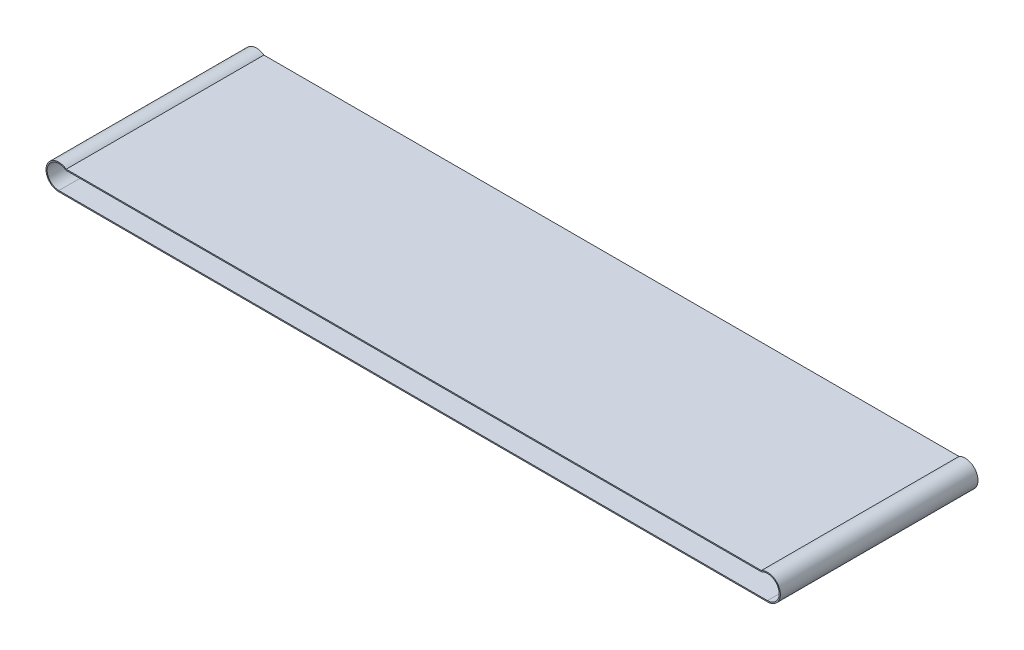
SolidWorks part; units mm, degrees
ref_plane "Plan de face" through (0, 0, 0) normal (0, 0, 1) x (1, 0, 0)
ref_plane "Plan de dessus" through (0, 0, 0) normal (0, 1, 0) x (1, 0, 0)
ref_plane "Plan de droite" through (0, 0, 0) normal (1, 0, 0) x (0, 0, -1)
sketch "Esquisse1" plane through (0, 0, 0) normal (0, 0, 1) x (1, 0, 0)
  line L0 (80.8181, 61.25) -> (1250.8181, 61.25) construction
  line L1 (50.4667, 61.25) -> (1282.6771, 61.25)
  line L2 (37.9774, 23.9119) -> (1292.9767, 22.5)
  circle A0 centre (1293, 43.25) radius 20.75 construction
  arc A1 (1292.9767, 22.5) -> (1282.6771, 61.25) centre (1293, 43.25) ccw
  circle A2 centre (38.0008, 44.6619) radius 20.75 construction
  arc A3 (50.4667, 61.25) -> (37.9774, 23.9119) centre (38.0008, 44.6619) ccw
extrude "Extru.-Mince1" add sketch "Esquisse1" along normal mid plane 350 thin
